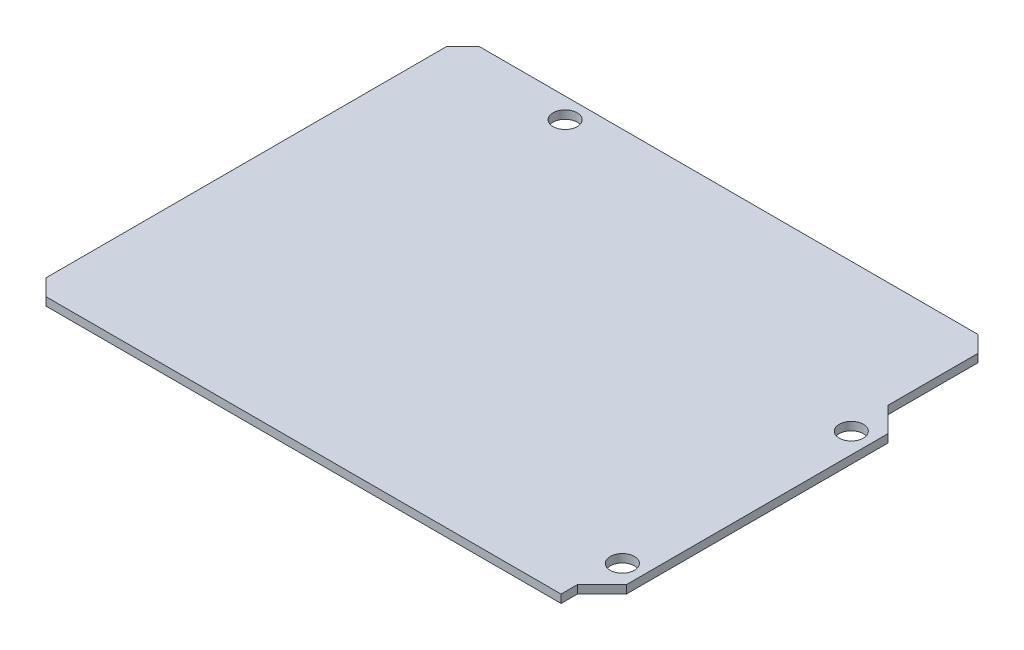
SolidWorks part; units mm, degrees
ref_plane "Front Plane" through (0, 0, 0) normal (0, 0, 1) x (1, 0, 0)
ref_plane "Top Plane" through (0, 0, 0) normal (0, 1, 0) x (1, 0, 0)
ref_plane "Right Plane" through (0, 0, 0) normal (1, 0, 0) x (0, 0, -1)
sketch "Sketch1" plane through (0, 0, 0) normal (0, 1, 0) x (1, 0, 0)
  line L0 (-34, 26.5) -> (34, -26.5) construction
  line L1 (-34, 26.5) -> (34, 26.5)
  line L2 (-34, 26.5) -> (-34, -26.5)
  line L3 (-34, -26.5) -> (34, -26.5)
  line L4 (34, 26.5) -> (34, -26.5)
  dimension "D1" = 68
  dimension "D2" = 53
extrude "Boss-Extrude1" add sketch "Sketch1" along normal blind 1
sketch "Sketch2" plane through (0, 1, 0) normal (0, 1, 0) x (-1, 0, 0)
  line L0 (-34, -26.5) -> (34, -26.5) construction
  line L1 (-34, 26.5) -> (-31, 26.5)
  line L2 (-34, 26.5) -> (-34, 21.5)
  line L3 (-34, 21.5) -> (-31, 24.5)
  line L4 (-31, 26.5) -> (-31, 24.5)
  line L5 (-34, -26.5) -> (-31, -26.5)
  line L6 (-34, -26.5) -> (-34, -10.5)
  line L7 (-34, -10.5) -> (-31, -13.5)
  line L8 (-31, -26.5) -> (-31, -13.5)
  line L9 (-34, 26.5) -> (-34, -26.5) construction
other "AlignGroup1" parameters "D1"=10.4542, "D2"=5.0337, "D3"=4.5886, "D4"=7.5335, "D5"=10.2329, "D6"=40
extrude "Cut-Extrude1" cut sketch "Sketch2" against normal up to next
chamfer "Chamfer2" distance 2 angle 45 3 edges at (-34, 0.5, 26.5) (-34, 0.5, -26.5) (31, 0.5, -26.5)
hole_wizard "#4 Clearance Hole1" positions "Sketch4" profile "Sketch5" hole size "#4" standard "Ansi Inch"
sketch "Sketch4"
  point P0 (-31.5, 19.5)
  point P1 (-31.5, -8.5)
  point P3 (19, -24)
other "AlignGroup2" parameters "D1"=0, "D2"=15, "D3"=65.5, "D4"=0, "D5"=7, "D6"=35, "D7"=50.5
other "AlignGroup3"
sketch "Sketch5" plane through (31.5, 1, 19.5) normal (1, 0, 0) x (0, 0, 1)
  line L0 (0, 0) -> (0, 1)
  line L1 (0, 1) -> (1.4732, 1)
  line L2 (1.4732, 1) -> (1.4732, 0)
  line L5 (1.4732, 0) -> (0, 0)
  line L11 (0, -6.35) -> (0, 107.95) construction
  dimension "Thru Hole Dia." = 2.9464
  dimension "Thru Hole Depth" = 1
